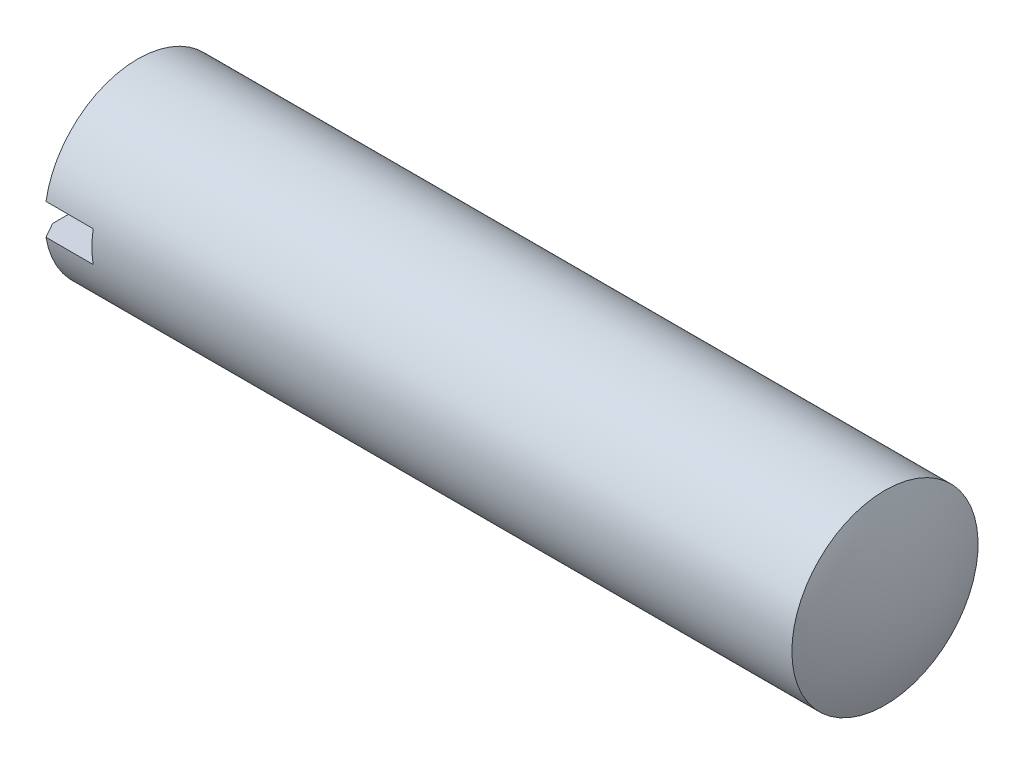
SolidWorks part; units mm, degrees
ref_plane "Plane1" through (0, 0, 0) normal (0, 0, 1) x (1, 0, 0)
ref_plane "Plane2" through (0, 0, 0) normal (0, 1, 0) x (1, 0, 0)
ref_plane "Plane3" through (0, 0, 0) normal (1, 0, 0) x (0, 0, -1)
sketch "BodySke" plane through (0, 0, 0) normal (0, 0, 1) x (1, 0, 0)
  line L0 (0.5566, -6) -> (47.1574, -6) construction
  line L1 (49.1049, 12.7) -> (49.1049, 3.175) construction
  line L2 (0.5566, 6) -> (48.7115, 6)
  line L4 (50, 0) -> (0, 0)
  line L5 (-12.7, 0) -> (88.9, 0) construction
  line L8 (1.75, 12.7) -> (1.75, -3.175) construction
  line L9 (0, 0) -> (0, 5.036)
  line L10 (0, 5.036) -> (0.5566, 6)
  line L11 (0, -5.036) -> (0.5566, -6) construction
  arc A0 (48.7115, 6) -> (50, 0) centre (35.3865, 0) cw
  dimension "Oval_rad" = 14.6135
  dimension "Length" = 50
  dimension "Diameter" = 12
  dimension "Drive_ch_ang" = 60
  dimension "Advance" = 1.75
  dimension "Minor_dia" = 10.072
  dimension "Thread_len" = 48.5483
revolve "BaseBody" add sketch "BodySke"
extrude "Slot" cut sketch "Sketch2" along normal blind 3.6
sketch "Sketch2" plane through (0, 0, 0) normal (1, 0, 0) x (0, 0, -1)
  line L1 (6, -1) -> (-6, -1)
  line L2 (6, -1) -> (6, 1)
  line L3 (6, 1) -> (-6, 1)
  line L4 (-6, -1) -> (-6, 1)
  dimension "D1" = 12
  dimension "D2" = 1
  dimension "Slot_width" = 2
  dimension "D3" = 6
sketch "ThdSchSke" plane through (0, 0, 0) normal (0, 0, 1) x (1, 0, 0)
  line L0 (0.5566, -5.036) -> (-0.1184, -6)
  line L1 (0.5566, -5.036) -> (1.2316, -6)
  line L2 (1.2316, -6) -> (1.2316, -7.5)
  line L3 (-3.175, 0) -> (5.1513, 0) construction
  line L5 (1.2316, -7.5) -> (-0.1184, -7.5)
  line L6 (-0.1184, -7.5) -> (-0.1184, -6)
  line L7 (0.5566, -6) -> (0.5566, -1) construction
  dimension "Thread_minor" = 10.072
  dimension "Diameter" = 12
  dimension "SideAngle" = 55
  dimension "VeeAngle" = 70
  dimension "Overcut" = 15
revolve "ThreadSchematic" [suppressed] cut sketch "ThdSchSke" angle 360 about L3
pattern_linear "ThdSchPat" [suppressed]
equation "\"D1@Sketch2\" = \"Diameter@BodySke\""
equation "\"D3@Sketch2\" = \"D1@Sketch2\" / 2"
equation "\"D2@Sketch2\" = \"Slot_width@Sketch2\" / 2"
equation "\"Thread_minor@ThdSchSke\" = \"Minor_dia@BodySke\""
equation "\"Diameter@ThdSchSke\" = \"Diameter@BodySke\""
equation "\"Overcut@ThdSchSke\" = \"Diameter@BodySke\" * 1.25"
equation "' \"Num_threads@ThdSchPat\" = int( (\"Length@BodySke\" - ( ( ( \"Diameter@BodySke\" - \"Minor_dia@BodySke\" ) * 0.5 ) / tan( \"Drive_ch_ang@BodySke\" * 0.017453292 ) ) - ( ( ( \"Diameter@BodySke\" - \"Cup_dia@Body"
equation "' \"Advance@ThdSchPat\" = (\"Length@BodySke\" - ( ( ( \"Diameter@BodySke\" - \"Minor_dia@BodySke\" ) * 0.5 ) / tan( \"Drive_ch_ang@BodySke\" * 0.017453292 ) ) - ( ( ( \"Diameter@BodySke\" - \"Cup_dia@BodySke\" ) * "
equation "' \"Num_threads@ThdSchPat\" = \"Num_threads@ThdSchPat\" - sgn( \"Num_threads@ThdSchPat\" - 1) '---chamfered tips only---"
equation "\"Thread_len@BodySke\" = \"Length@BodySke\" -  ( ( ( \"Diameter@BodySke\" - \"Minor_dia@BodySke\" ) * 0.5 ) / tan( \"Drive_ch_ang@BodySke\" * 0.017453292 ) )"
equation "\"Thread_len@BodySke\" = \"Thread_len@BodySke\" - \"Oval_rad@BodySke\" + sqr(\"Oval_rad@BodySke\" * \"Oval_rad@BodySke\" - (\"Minor_dia@BodySke\" / 2) * (\"Minor_dia@BodySke\" / 2))"
equation "\"Num_threads@ThdSchPat\" = int( \"Thread_len@BodySke\" / \"Advance@BodySke\" + 0.999 ) + 1"
equation "\"Advance@ThdSchPat\" = \"Thread_len@BodySke\" /  (\"Num_threads@ThdSchPat\" - 1)"
